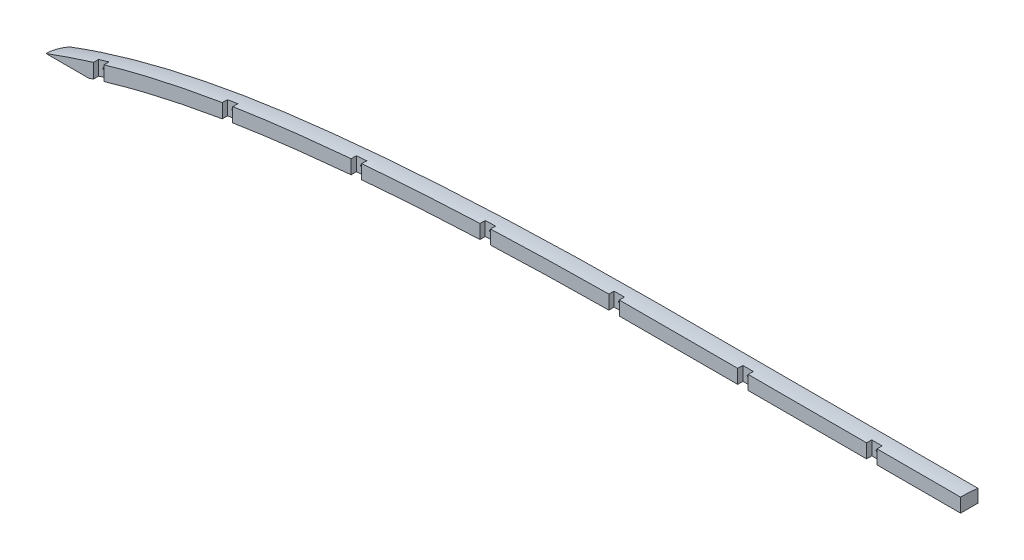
SolidWorks part; units mm, degrees
ref_plane "Front" through (0, 0, 0) normal (0, 0, 1) x (1, 0, 0)
ref_plane "Top" through (0, 0, 0) normal (0, 1, 0) x (1, 0, 0)
ref_plane "Right" through (0, 0, 0) normal (1, 0, 0) x (0, 0, -1)
sketch "Sketch2" plane through (0, 0, 0) normal (0, 1, 0) x (-1, 0, 0)
  line L1 (1096.3058, 0) -> (-635, 0)
  line L2 (-635, 0) -> (-635, -31.75)
  line L3 (-635, -31.75) -> (1096.3058, -31.75)
  line L5 (1096.3058, -31.75) -> (1096.3058, 0)
  line L7 (1080.4308, 0) -> (-635, 0) construction
  line L8 (-635, 0) -> (-635, -266.6999) construction
  line L11 (1096.3058, -101.6) -> (1096.3058, -15.875) construction
  dimension "D1" = 31.75
extrude "Extrude1" add sketch "Sketch2" along normal up to surface (258.4068 mm away)
sketch "Sketch5" plane through (0, 0, 0) normal (0, 0, 1) x (1, 0, 0)
  line L0 (635, 0) -> (710.6533, 0)
  line L1 (-1096.3058, 0) -> (635, 0) construction
  line L3 (-1096.3058, 0) -> (635, 0)
  line L4 (-954.877, 127) -> (-1096.3058, 127)
  line L5 (-1096.3058, 127) -> (-1096.3058, 0)
  line L6 (710.6533, 0) -> (710.6533, 234.95)
  line L7 (710.6533, 234.95) -> (634.9864, 234.95)
  spline S2 degree 3 number of poles 72 (634.9864, 234.95) -> (-1086.307, 78.2508)
  spline S3 degree 3 number of poles 72 (634.9864, 234.95) -> (-954.877, 127)
  dimension "D2" = 127
  dimension "D1" = 25.4
extrude "Cut-Extrude1" cut sketch "Sketch5" against normal through all
sketch "Sketch6" plane through (0, 0, 0) normal (0, 0, 1) x (1, 0, 0)
  line L0 (635, 260.35) -> (635, 234.95) construction
  line L1 (-946.1394, 304.4575) -> (-927.0894, 304.4575)
  line L2 (-946.1394, 304.4575) -> (-946.1394, 119.3417)
  line L3 (-946.1394, 119.3417) -> (-927.0894, 119.3417)
  line L4 (-927.0894, 304.4575) -> (-927.0894, 119.3417)
  line L5 (-711.1894, 304.4575) -> (-692.1394, 304.4575)
  line L6 (-711.1894, 304.4575) -> (-711.1894, 119.3417)
  line L7 (-711.1894, 119.3417) -> (-692.1394, 119.3417)
  line L8 (-1257.5127, 0) -> (1574.5603, 0) construction
  line L9 (-692.1394, 304.4575) -> (-692.1394, 119.3417)
  line L10 (-701.6644, 98.0278) -> (-701.6644, 379.6404) construction
  line L11 (-476.2394, 304.4575) -> (-457.1894, 304.4575)
  line L12 (-476.2394, 304.4575) -> (-476.2394, 119.3417)
  line L13 (-476.2394, 119.3417) -> (-457.1894, 119.3417)
  line L14 (-457.1894, 304.4575) -> (-457.1894, 119.3417)
  line L15 (-466.7144, 98.0278) -> (-466.7144, 379.6404) construction
  line L16 (-241.2894, 304.4575) -> (-222.2394, 304.4575)
  line L17 (-241.2894, 304.4575) -> (-241.2894, 119.3417)
  line L18 (-241.2894, 119.3417) -> (-222.2394, 119.3417)
  line L19 (-222.2394, 304.4575) -> (-222.2394, 119.3417)
  line L20 (-231.7644, 98.0278) -> (-231.7644, 379.6404) construction
  line L21 (-6.3394, 304.4575) -> (12.7106, 304.4575)
  line L22 (-6.3394, 304.4575) -> (-6.3394, 119.3417)
  line L23 (-6.3394, 119.3417) -> (12.7106, 119.3417)
  line L24 (12.7106, 304.4575) -> (12.7106, 119.3417)
  line L25 (3.1856, 98.0278) -> (3.1856, 379.6404) construction
  line L26 (228.6106, 304.4575) -> (247.6606, 304.4575)
  line L27 (228.6106, 304.4575) -> (228.6106, 119.3417)
  line L28 (228.6106, 119.3417) -> (247.6606, 119.3417)
  line L29 (-936.6144, 98.0278) -> (-936.6144, 379.6404) construction
  line L30 (247.6606, 304.4575) -> (247.6606, 119.3417)
  line L31 (238.1356, 98.0278) -> (238.1356, 379.6404) construction
  line L32 (463.5606, 304.4575) -> (482.6106, 304.4575)
  line L33 (463.5606, 304.4575) -> (463.5606, 119.3417)
  line L34 (463.5606, 119.3417) -> (482.6106, 119.3417)
  line L35 (482.6106, 304.4575) -> (482.6106, 119.3417)
  line L36 (473.0856, 98.0278) -> (473.0856, 379.6404) construction
  spline S3 degree 3 poles (635, 247.65) (630.8242, 247.6522) (626.6397, 247.6502) (618.267, 247.6492) (614.0814, 247.6496) (601.5269, 247.6504) (593.1575, 247.6501) (568.0484, 247.6498) (551.3086, 247.65) (501.09, 247.65) (467.6106, 247.65) (400.6521, 247.6501) (367.1729, 247.6499) (329.5086, 247.6501) (325.3236, 247.6502) (316.9546, 247.6501) (312.7668, 247.6497) (300.2056, 247.6535) (291.8301, 247.6618) (266.7082, 247.6984) (249.9631, 247.739) (166.2511, 247.9679) (99.3258, 248.2333) (-0.9905, 247.6957) (-34.4199, 247.3569) (-101.2572, 246.2272) (-134.6632, 245.4371) (-201.4493, 243.3024) (-234.8354, 241.9629) (-284.8965, 239.553) (-301.5808, 238.6838) (-334.9393, 236.8088) (-351.6117, 235.8015) (-384.938, 233.6233) (-401.5923, 232.4523) (-434.8801, 229.922) (-451.5123, 228.5621) (-484.7583, 225.6327) (-501.3735, 224.0654) (-526.2838, 221.5673) (-534.5849, 220.7101) (-551.1841, 218.948) (-559.4819, 218.0434) (-584.3586, 215.2558) (-600.9205, 213.2954) (-625.7178, 210.1368) (-633.9759, 209.0477) (-650.4751, 206.7859) (-658.7154, 205.6128) (-699.8812, 199.5176) (-732.7134, 193.9105) (-798.0873, 181.2531) (-830.5999, 174.1935) (-895.0943, 158.1492) (-927.0891, 149.1625) (-958.7254, 139.1029) knots 0 0 0 0 0.007812 0.007812 0.015625 0.015625 0.03125 0.03125 0.0625 0.0625 0.125 0.125 0.1875 0.1875 0.195312 0.195312 0.203125 0.203125 0.21875 0.21875 0.25 0.25 0.375 0.375 0.4375 0.4375 0.5 0.5 0.5625 0.5625 0.59375 0.59375 0.625 0.625 0.65625 0.65625 0.6875 0.6875 0.71875 0.71875 0.734375 0.734375 0.75 0.75 0.78125 0.78125 0.796875 0.796875 0.8125 0.8125 0.875 0.875 0.9375 0.9375 1 1 1 1 construction
  dimension "D1" = 19.05
  dimension "D2" = 96.012
  dimension "D3" = 161.9144
  dimension "D5" = 396.8644
  dimension "D6" = 631.8144
  dimension "D7" = 866.7644
  dimension "D8" = 1101.7144
  dimension "D9" = 1336.6644
  dimension "D4" = 1571.6144
extrude "Cut-Extrude3" cut sketch "Sketch6" against normal blind 9.525
hole_wizard "#8-32 Tapped Hole1" positions "Sketch11" profile "Sketch10" tap size "#8-32" standard "Ansi Inch"
sketch "Sketch11" plane through (0, 0, -9.525) normal (0, 0, 1) x (1, 0, 0)
  line L0 (-936.6144, 205.5477) -> (-936.6144, 86.3387) construction
  line L1 (-701.6644, 258.8508) -> (-701.6644, 139.1029) construction
  line L2 (-466.7144, 295.4388) -> (-466.7144, 177.3755) construction
  line L3 (-231.7644, 313.9306) -> (-231.7644, 199.3798) construction
  line L4 (3.1856, 313.9306) -> (3.1856, 177.3755) construction
  line L5 (238.1356, 313.9306) -> (238.1356, 177.3755) construction
  line L6 (473.0856, 313.9306) -> (473.0856, 177.3755) construction
  line L7 (-946.1394, 156.3269) -> (-946.1394, 129.7481) construction
  line L8 (-927.0894, 135.5335) -> (-927.0894, 162.0068) construction
  line L9 (-692.1394, 187.6564) -> (-692.1394, 213.3778) construction
  line L10 (-711.1894, 210.2709) -> (-711.1894, 184.5135) construction
  line L11 (-476.2394, 239.1264) -> (-476.2394, 213.6235) construction
  line L12 (-457.1894, 215.3004) -> (-457.1894, 240.7929) construction
  line L13 (-241.2894, 254.3061) -> (-241.2894, 228.8817) construction
  line L14 (-222.2394, 229.6889) -> (-222.2394, 255.1099) construction
  line L21 (-6.3394, 260.293) -> (-6.3394, 234.8917) construction
  line L22 (12.7106, 235.0499) -> (12.7106, 260.4511) construction
  line L23 (228.6106, 260.4974) -> (228.6106, 235.0974) construction
  line L24 (247.6606, 235.0468) -> (247.6606, 260.4468) construction
  line L25 (482.6106, 234.9501) -> (482.6106, 260.35) construction
  line L26 (463.5606, 260.35) -> (463.5606, 234.9501) construction
  spline S2 degree 3 poles (634.9932, 247.65) (630.8174, 247.6522) (626.6329, 247.6502) (618.2602, 247.6492) (614.0747, 247.6496) (601.5203, 247.6504) (593.1508, 247.6501) (568.0419, 247.6498) (551.3021, 247.65) (501.0837, 247.65) (467.6045, 247.65) (400.6463, 247.65) (367.1673, 247.6498) (329.5031, 247.65) (325.3181, 247.6501) (316.9492, 247.65) (312.7614, 247.6496) (300.2002, 247.6534) (291.8247, 247.6617) (266.703, 247.6983) (249.9579, 247.7389) (166.2463, 247.9678) (99.3213, 248.2332) (-0.9946, 247.6955) (-34.4239, 247.3568) (-101.2608, 246.227) (-134.6667, 245.4369) (-201.4526, 243.3022) (-234.8385, 241.9627) (-284.8994, 239.5527) (-301.5837, 238.6835) (-334.942, 236.8086) (-351.6143, 235.8013) (-384.9405, 233.6231) (-401.5947, 232.452) (-434.8823, 229.9218) (-451.5144, 228.5619) (-484.7603, 225.6324) (-501.3754, 224.0651) (-526.2857, 221.5671) (-534.5867, 220.7099) (-551.1858, 218.9478) (-559.4836, 218.0432) (-584.3602, 215.2556) (-600.922, 213.2952) (-625.7192, 210.1366) (-633.9773, 209.0475) (-650.4765, 206.7857) (-658.7167, 205.6126) (-699.8824, 199.5175) (-732.7144, 193.9104) (-798.088, 181.2529) (-830.6004, 174.1934) (-895.0946, 158.1491) (-927.0892, 149.1625) (-958.7254, 139.1029) knots 0 0 0 0 0.007812 0.007812 0.015625 0.015625 0.03125 0.03125 0.0625 0.0625 0.125 0.125 0.1875 0.1875 0.195312 0.195312 0.203125 0.203125 0.21875 0.21875 0.25 0.25 0.375 0.375 0.4375 0.4375 0.5 0.5 0.5625 0.5625 0.59375 0.59375 0.625 0.625 0.65625 0.65625 0.6875 0.6875 0.71875 0.71875 0.734375 0.734375 0.75 0.75 0.78125 0.78125 0.796875 0.796875 0.8125 0.8125 0.875 0.875 0.9375 0.9375 1 1 1 1
  spline S3 degree 3 poles (634.9932, 247.65) (630.8174, 247.6522) (626.6329, 247.6502) (618.2602, 247.6492) (614.0747, 247.6496) (601.5203, 247.6504) (593.1508, 247.6501) (568.0419, 247.6498) (551.3021, 247.65) (501.0837, 247.65) (467.6045, 247.65) (400.6463, 247.65) (367.1673, 247.6498) (329.5031, 247.65) (325.3181, 247.6501) (316.9492, 247.65) (312.7614, 247.6496) (300.2002, 247.6534) (291.8247, 247.6617) (266.703, 247.6983) (249.9579, 247.7389) (166.2463, 247.9678) (99.3213, 248.2332) (-0.9946, 247.6955) (-34.4239, 247.3568) (-101.2608, 246.227) (-134.6667, 245.4369) (-201.4526, 243.3022) (-234.8385, 241.9627) (-284.8994, 239.5527) (-301.5837, 238.6835) (-334.942, 236.8086) (-351.6143, 235.8013) (-384.9405, 233.6231) (-401.5947, 232.452) (-434.8823, 229.9218) (-451.5144, 228.5619) (-484.7603, 225.6324) (-501.3754, 224.0651) (-526.2857, 221.5671) (-534.5867, 220.7099) (-551.1858, 218.9478) (-559.4836, 218.0432) (-584.3602, 215.2556) (-600.922, 213.2952) (-625.7192, 210.1366) (-633.9773, 209.0475) (-650.4765, 206.7857) (-658.7167, 205.6126) (-699.8824, 199.5175) (-732.7144, 193.9104) (-798.088, 181.2529) (-830.6004, 174.1934) (-895.0946, 158.1491) (-927.0892, 149.1625) (-958.7254, 139.1029) knots 0 0 0 0 0.007812 0.007812 0.015625 0.015625 0.03125 0.03125 0.0625 0.0625 0.125 0.125 0.1875 0.1875 0.195312 0.195312 0.203125 0.203125 0.21875 0.21875 0.25 0.25 0.375 0.375 0.4375 0.4375 0.5 0.5 0.5625 0.5625 0.59375 0.59375 0.625 0.625 0.65625 0.65625 0.6875 0.6875 0.71875 0.71875 0.734375 0.734375 0.75 0.75 0.78125 0.78125 0.796875 0.796875 0.8125 0.8125 0.875 0.875 0.9375 0.9375 1 1 1 1 construction
  point P0 (-936.6144, 145.9432)
  point P46 (-701.6644, 198.9768)
  point P47 (-466.7144, 227.2223)
  point P48 (-231.7644, 242.004)
  point P49 (3.1856, 247.6755)
  point P50 (238.1356, 247.7714)
  point P51 (473.0856, 247.65)
  dimension "D1" = 12.7
sketch "Sketch10" plane through (-936.6144, 145.9432, -9.525) normal (1, 0, 0) x (0, -1, 0)
  line L0 (0, 0) -> (0, 11.7464)
  line L1 (0, 11.7464) -> (1.7272, 10.7086)
  line L2 (1.7272, 10.7086) -> (1.7272, 0)
  line L5 (1.7272, 0) -> (0, 0)
  line L10 (0, 11.7464) -> (-1.7272, 10.7086) construction
  line L11 (0, -6.35) -> (0, 107.95) construction
  dimension "Tap Drill Dia." = 3.4544
  dimension "Tap Drill Depth" = 10.7086
  dimension "Drill Angle" = 118
